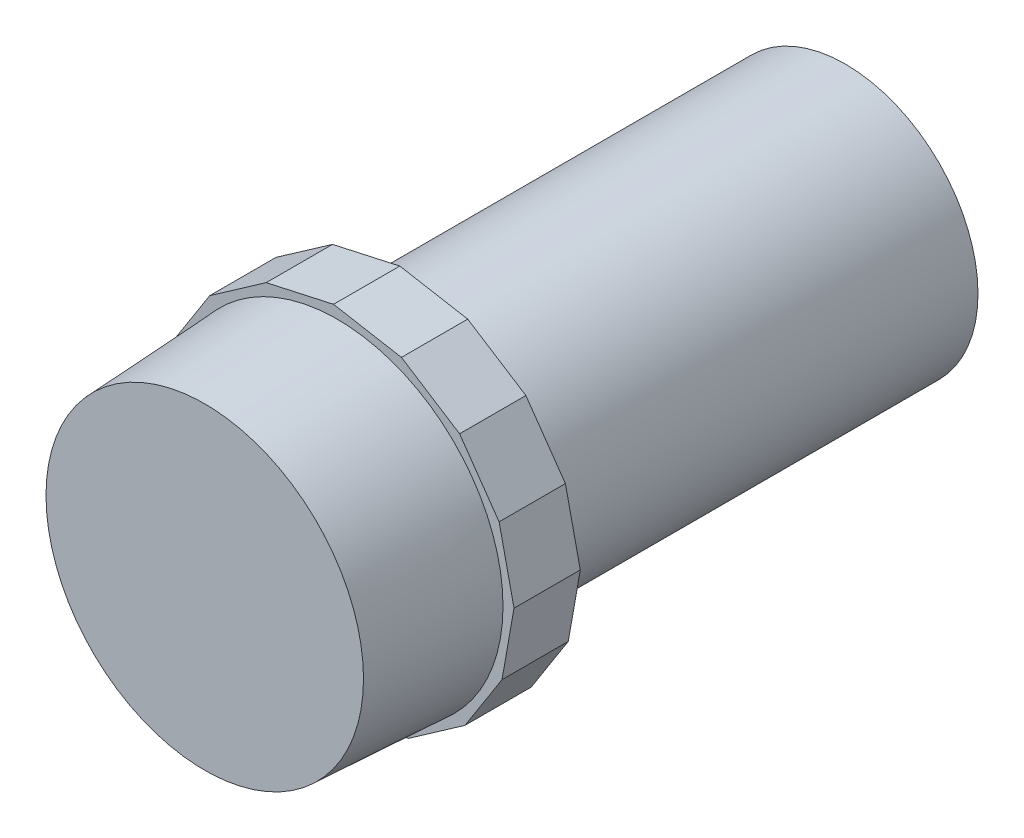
SolidWorks part; units mm, degrees
ref_plane "Alzado" through (0, 0, 0) normal (0, 0, 1) x (1, 0, 0)
ref_plane "Planta" through (0, 0, 0) normal (0, 1, 0) x (1, 0, 0)
ref_plane "Vista lateral" through (0, 0, 0) normal (1, 0, 0) x (0, 0, -1)
sketch "Croquis1" plane through (0, 0, 0) normal (0, 0, 1) x (1, 0, 0)
  circle A0 centre (0, 0) radius 7.5
  dimension "D1" = 15
extrude "Saliente-Extruir1" add sketch "Croquis1" along normal blind 6 draft 3
sketch "Croquis2" plane through (0, 0, 0) normal (0, 0, -1) x (-1, 0, 0)
  circle A0 centre (0, 0) radius 8
  dimension "D1" = 16
extrude "Saliente-Extruir6" add sketch "Croquis2" along normal blind 3
sketch "Croquis6" plane through (0, 0, -3) normal (0, 0, -1) x (-1, 0, 0)
  line L1 (7.3241, -3.2184) -> (7.9982, -0.1706)
  line L2 (7.9982, -0.1706) -> (7.4546, 2.9032)
  line L3 (7.4546, 2.9032) -> (5.7762, 5.5349)
  line L4 (5.7762, 5.5349) -> (3.2184, 7.3241)
  line L5 (3.2184, 7.3241) -> (0.1706, 7.9982)
  line L6 (0.1706, 7.9982) -> (-2.9032, 7.4546)
  line L7 (-2.9032, 7.4546) -> (-5.5349, 5.7762)
  line L8 (-5.5349, 5.7762) -> (-7.3241, 3.2184)
  line L9 (-7.3241, 3.2184) -> (-7.9982, 0.1706)
  line L10 (-7.9982, 0.1706) -> (-7.4546, -2.9032)
  line L11 (-7.4546, -2.9032) -> (-5.7762, -5.5349)
  line L12 (-5.7762, -5.5349) -> (-3.2184, -7.3241)
  line L13 (-3.2184, -7.3241) -> (-0.1706, -7.9982)
  line L14 (-0.1706, -7.9982) -> (2.9032, -7.4546)
  line L15 (2.9032, -7.4546) -> (5.5349, -5.7762)
  line L16 (5.5349, -5.7762) -> (7.3241, -3.2184)
  circle A0 centre (0, 0) radius 7.8463 construction
  circle A1 centre (0, 0) radius 8
extrude "Cortar-Extruir2" cut sketch "Croquis6" against normal blind 3 contours L6 M1 | L5 M1 | L4 M1 | L3 M1 | L2 M1 | L1 M1 | L16 M1 | L15 M1 | L14 M1 | L12 M1 | L13 M1 | L11 M1 | L10 M1 | L9 M1 | L8 M1 | L7 M1
sketch "Croquis7" plane through (0, 0, -3) normal (0, 0, -1) x (-1, 0, 0)
  circle A0 centre (0, 0) radius 6
  dimension "D1" = 12
extrude "Saliente-Extruir7" add sketch "Croquis7" along normal blind 20
